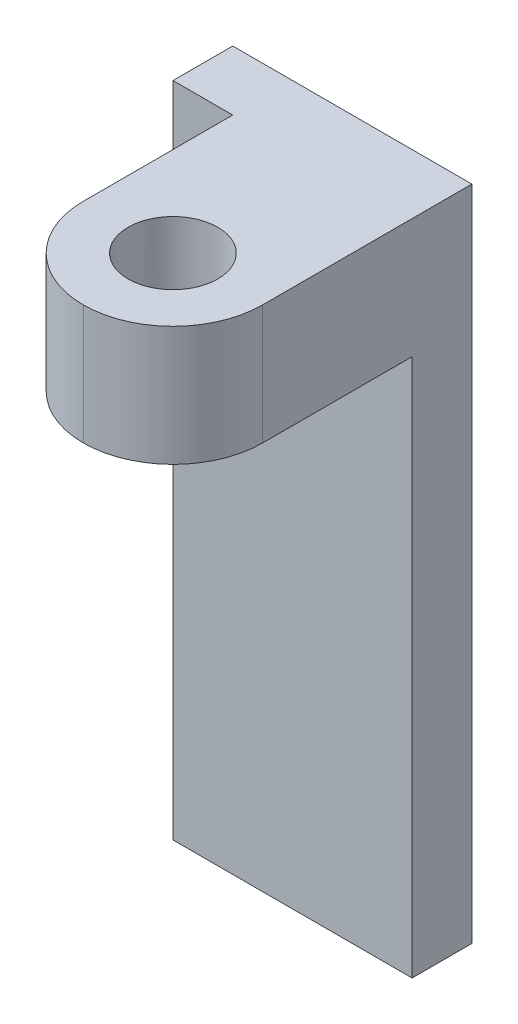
SolidWorks part; units mm, degrees
ref_plane "Plane1" through (0, 0, 0) normal (0, 0, 1) x (1, 0, 0)
ref_plane "Plane2" through (0, 0, 0) normal (0, 1, 0) x (1, 0, 0)
ref_plane "Plane3" through (0, 0, 0) normal (1, 0, 0) x (0, 0, -1)
sketch "Sketch1"
  dimension "D1" = 139.7
  dimension "D2" = 50.8
  dimension "D3" = 101.6
  dimension "D4" = 66.675
extrude "Base-Extrude" add sketch "Sketch1" along normal blind 12.7
sketch "Sketch2"
  dimension "D1" = 53.975
  dimension "D2" = 25.4
  dimension "D3" = 38.1
extrude "Boss-Extrude1" add sketch "Sketch2" along normal blind 50.8
fillet "Fillet1" radius 19.05
sketch "Sketch3"
  dimension "D1" = 19.05
extrude "Cut-Extrude1" cut sketch "Sketch3" against normal up to next
